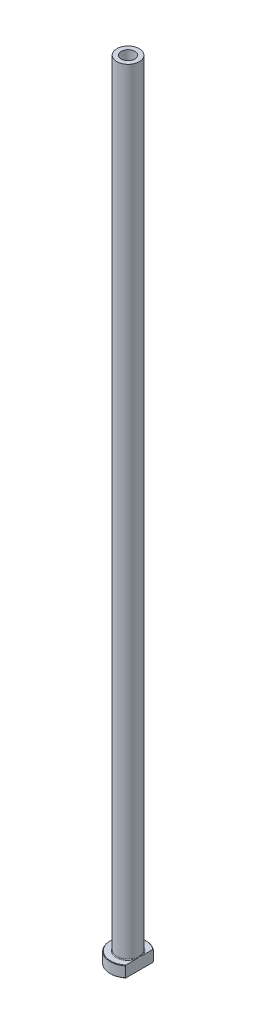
SolidWorks part; units mm, degrees
ref_plane "Front Plane" through (0, 0, 0) normal (0, 0, 1) x (1, 0, 0)
ref_plane "Top Plane" through (0, 0, 0) normal (0, 1, 0) x (1, 0, 0)
ref_plane "Right Plane" through (0, 0, 0) normal (1, 0, 0) x (0, 0, -1)
sketch "Sketch1" plane through (0, 0, 0) normal (0, 0, 1) x (1, 0, 0)
  line L0 (-3, 350) -> (-5, 350)
  line L1 (-5, 350) -> (-5, 5)
  line L2 (-5, 5) -> (-8, 5)
  line L3 (-8, 5) -> (-8, 0)
  line L4 (7.15, 0) -> (-7.15, 0) construction
  line L5 (-8, 0) -> (-3.25, 0)
  line L6 (-3, 305) -> (-3, 350)
  line L7 (0, 92.1877) -> (0, -15.5353) construction
  line L8 (0, -8.8) -> (0, 8.8) construction
  line L9 (-3, 305) -> (-3.25, 293)
  line L10 (-3.25, 293) -> (-3.25, 0)
  dimension "D1" = 0.25
  dimension "ID" = 6
  dimension "OD" = 10
  dimension "L" = 350
  dimension "H" = 16
  dimension "T" = 5
  dimension "N" = 45
  dimension "D2" = 12
  dimension "L-N" = 305
revolve "Revolve1" add sketch "Sketch1" angle 360 about L7
fillet "Fillet1" radius 0.3 1 edges at (0, 5, 5)
chamfer "Chamfer1" distance 0.2 angle 45 2 edges at (0, 5, 8) (0, 0, 8)
sketch "Sketch2" plane through (0, 0, 0) normal (0, -1, 0) x (1, 0, 0)
  line L0 (5, 6.245) -> (5, -6.245)
  circle A0 centre (0, 0) radius 8 construction
  arc A1 (5, 6.245) -> (5, -6.245) centre (0, 0) cw
  circle A2 centre (0, 0) radius 5 construction
extrude "Cut-Extrude1" cut sketch "Sketch2" against normal through all
chamfer "Chamfer2" distance 0.5 angle 45 1 edges at (0, 0, 3.25)
